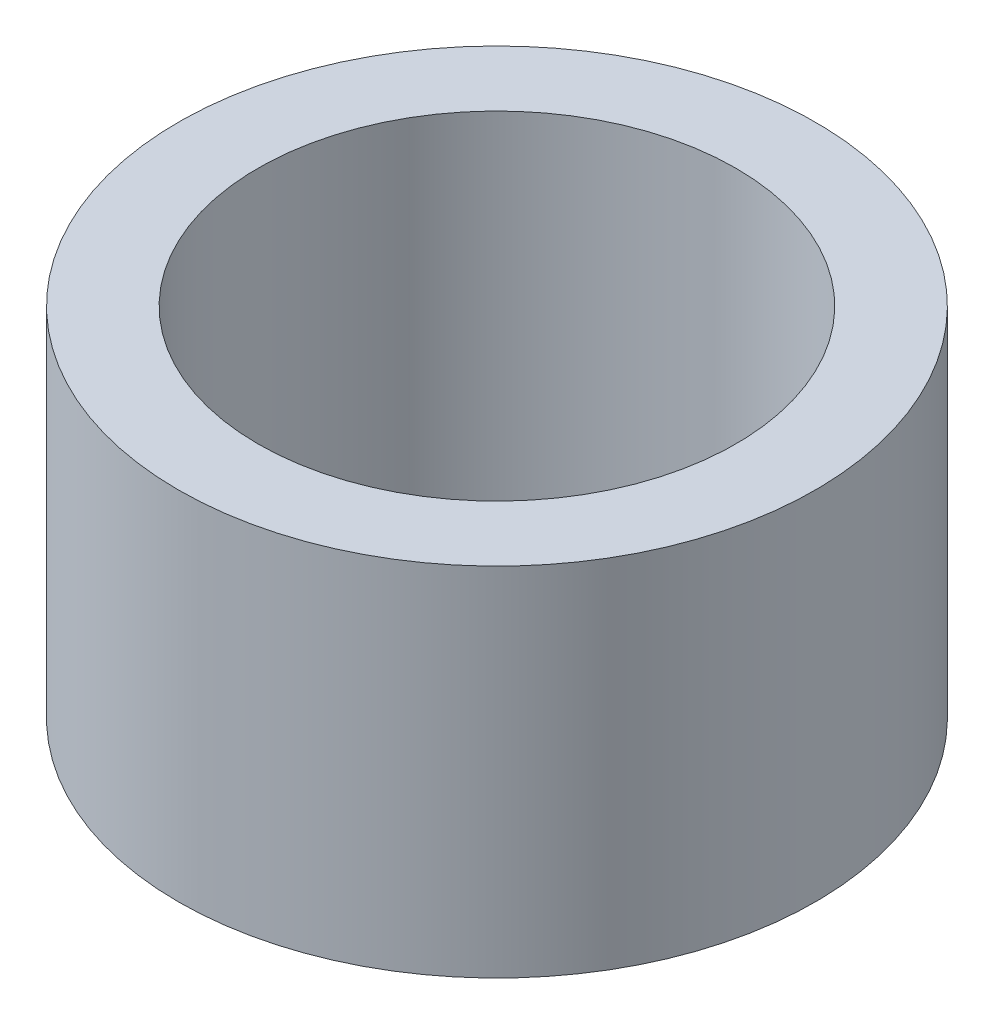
SolidWorks part; units mm, degrees
ref_plane "Front Plane" through (0, 0, 0) normal (0, 0, 1) x (1, 0, 0)
ref_plane "Top Plane" through (0, 0, 0) normal (0, 1, 0) x (1, 0, 0)
ref_plane "Right Plane" through (0, 0, 0) normal (1, 0, 0) x (0, 0, -1)
sketch "Sketch1" plane through (0, 0, 0) normal (0, 1, 0) x (1, 0, 0)
  circle A0 centre (0, 0) radius 6.35
  circle A1 centre (0, 0) radius 4.7625
  dimension "D1" = 9.525
  dimension "D2" = 12.7
extrude "Extrude1" add sketch "Sketch1" along normal blind 7.112
